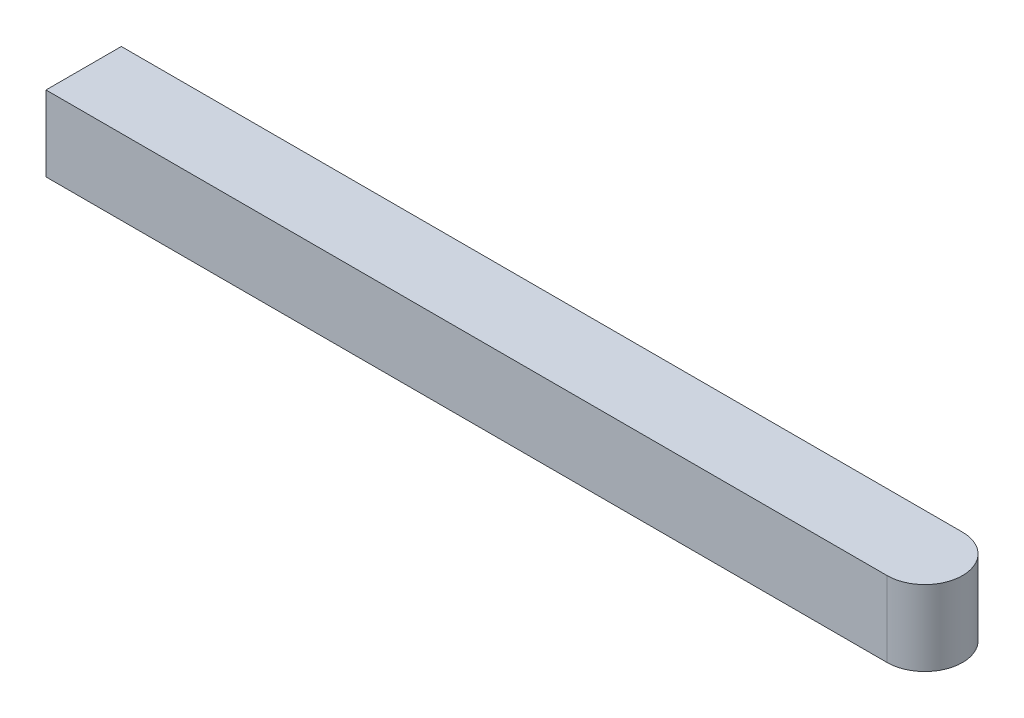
SolidWorks part; units mm, degrees
ref_plane "Plan de face" through (0, 0, 0) normal (0, 0, 1) x (1, 0, 0)
ref_plane "Plan de dessus" through (0, 0, 0) normal (0, 1, 0) x (1, 0, 0)
ref_plane "Plan de droite" through (0, 0, 0) normal (1, 0, 0) x (0, 0, -1)
sketch "Esquisse1" plane through (0, 0, 0) normal (0, 1, 0) x (1, 0, 0)
  line L0 (0, 3) -> (0, -3)
  line L1 (0, 3) -> (67, 3)
  line L2 (67, -3) -> (0, -3)
  arc A0 (67, 3) -> (67, -3) centre (67, 0) cw
  dimension "D1" = 6
  dimension "D2" = 70
extrude "Extrusion1" add sketch "Esquisse1" along normal mid plane 6
